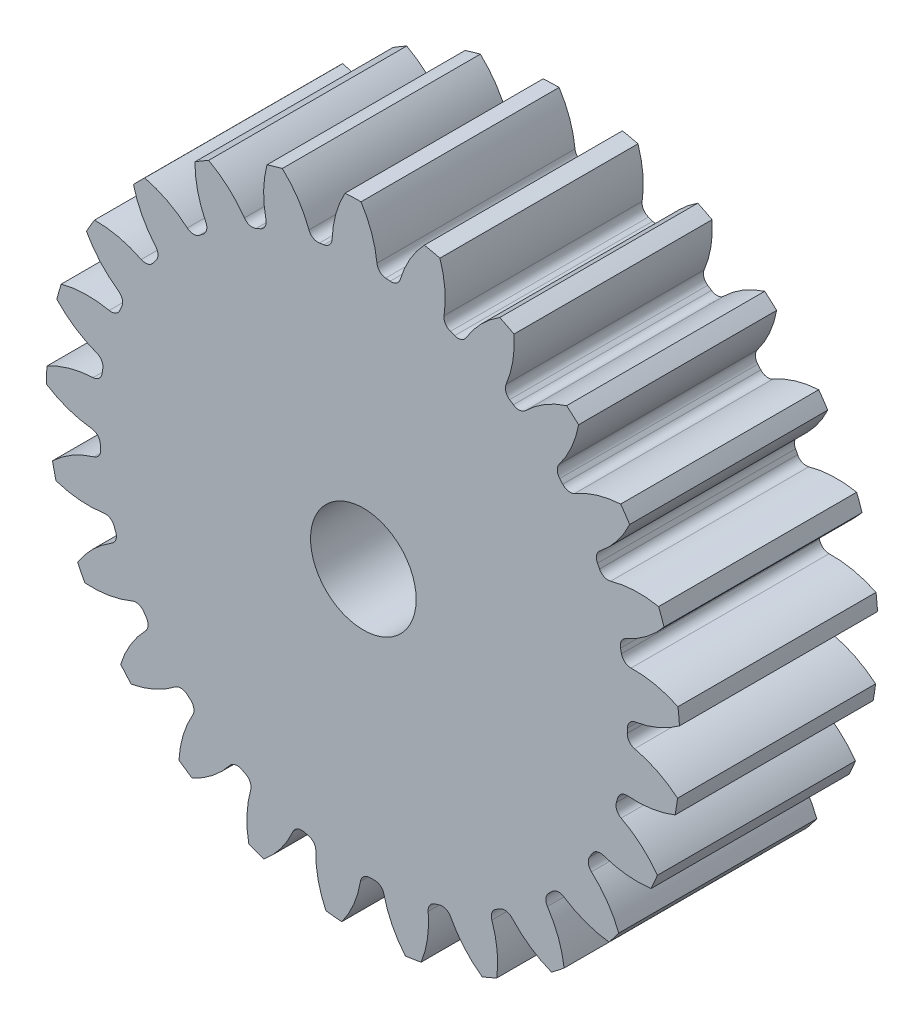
SolidWorks part; units mm, degrees
ref_plane "Front" through (0, 0, 0) normal (0, 0, 1) x (1, 0, 0)
ref_plane "Top" through (0, 0, 0) normal (0, 1, 0) x (1, 0, 0)
ref_plane "Right" through (0, 0, 0) normal (1, 0, 0) x (0, 0, -1)
sketch "Sketch3" plane through (0, 0, 0) normal (0, 0, 1) x (1, 0, 0)
  circle A0 centre (0, 0) radius 152.4
  dimension "od" = 304.8
extrude "gearBody" add sketch "Sketch3" along normal blind 95.25
sketch "Sketch2" plane through (0, 0, 0) normal (0, 0, 1) x (1, 0, 0)
  line L0 (0, 0) -> (122.5074, 50.7442) construction
  line L1 (151.4551, -20.1786) -> (0, 0) construction
  line L2 (0, 0) -> (36.3143, 0) construction
  line L3 (141.0375, 4.558) -> (140.5016, -13.1017) construction
  line L5 (140.7695, -4.2718) -> (0, 0) construction
  line L7 (0, 0) -> (132.6011, 0) construction
  arc A0 (132.5858, 2.0107) -> (132.2199, -10.0466) centre (0, 0) ccw construction
  arc A1 (152.0254, 10.6791) -> (151.0981, -19.8777) centre (0, 0) ccw construction
  arc A2 (141.0375, 4.558) -> (140.5016, -13.1017) centre (0, 0) ccw construction
  arc A3 (126.9036, -4.9484) -> (126.9701, -2.7557) centre (0, 0) ccw
  arc A4 (151.4551, -20.1786) -> (130.4559, -9.6031) centre (119.205, -58.0793) ccw
  arc A5 (151.4551, -20.1786) -> (152.4, 10.9578) centre (0, 0) ccw
  arc A6 (152.4, 10.9578) -> (130.7981, 1.675) centre (122.5074, 50.7442) cw
  arc A7 (126.9701, -2.7557) -> (130.7981, 1.675) centre (131.5636, -2.8554) cw
  arc A8 (130.4559, -9.6031) -> (126.9036, -4.9484) centre (131.4946, -5.1274) cw
  point P6 (152.4, 10.9578)
  point P22 (151.4551, -20.1786)
  dimension "baseDia" = 265.2021
  dimension "od" = 304.8
  dimension "pd" = 282.2222
  dimension "rd" = 254
  dimension "rFillet" = 4.5946
  dimension "pointX" = 152.4
  dimension "pointY" = 10.9578
  dimension "CTT" = 17.6597
  dimension "flankCenterAngle" = 22.5
extrude "toothCut" cut sketch "Sketch2" along normal through all
pattern_circular "CirPattern1" count 25 over 360 about axis through (0, 0, 0) along (0, 0, 1) of "toothCut"
sketch "hub1Dia" plane through (0, 0, 0) normal (0, 0, -1) x (-1, 0, 0)
  circle A0 centre (0, 0) radius 12.7
  dimension "hub1Dia" = 25.4
sketch "hub2Dia" plane through (0, 0, 95.25) normal (0, 0, 1) x (1, 0, 0)
  circle A0 centre (0, 0) radius 12.7
  dimension "hub2dia" = 25.4
sketch "boreDia" plane through (0, 0, 0) normal (0, 0, 1) x (1, 0, 0)
  circle A0 centre (0, 0) radius 25.4
  dimension "boreDia" = 50.8
extrude "bore" cut sketch "boreDia" against normal mid plane 25400
